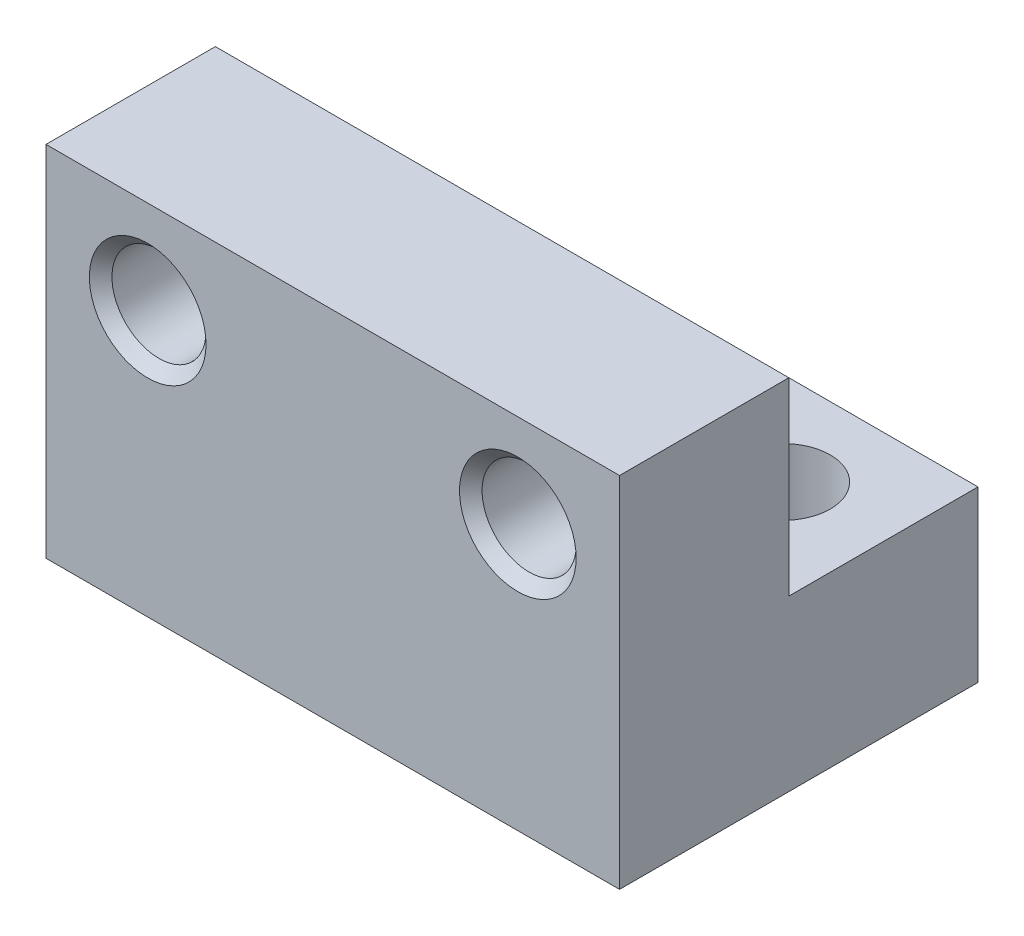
SolidWorks part; units mm, degrees
ref_plane "Front Plane" through (0, 0, 0) normal (0, 0, 1) x (1, 0, 0)
ref_plane "Top Plane" through (0, 0, 0) normal (0, 1, 0) x (1, 0, 0)
ref_plane "Right Plane" through (0, 0, 0) normal (1, 0, 0) x (0, 0, -1)
sketch "Sketch1" plane through (0, 0, 0) normal (1, 0, 0) x (0, 0, -1)
  line L0 (0, 0) -> (0, 9.525)
  line L1 (0, 9.525) -> (4.5, 9.525)
  line L2 (4.5, 9.525) -> (4.5, 4.5)
  line L3 (4.5, 4.5) -> (9.525, 4.5)
  line L4 (9.525, 4.5) -> (9.525, 0)
  line L5 (9.525, 0) -> (0, 0)
  line L6 (0, 0) -> (0.3027, 0)
  dimension "D1" = 9.525
  dimension "D2" = 9.525
  dimension "D3" = 4.5
  dimension "D4" = 4.5
extrude "Boss-Extrude1" add sketch "Sketch1" along normal blind 15.24 contours L5 L4 L3 L2 L1 L0
hole_wizard "M3x0.5 Tapped Hole1" positions "Sketch3" profile "Sketch2" tap size "M3x0.5" standard "Ansi Metric"
sketch "Sketch3" plane through (0, 0, 0) normal (0, 0, 1) x (1, 0, 0)
  line L1 (15.24, 0) -> (0, 0) construction
  line L2 (7.62, 0) -> (7.62, 9.525) construction
  line L3 (15.24, 9.525) -> (0, 9.525) construction
  point P0 (2.7025, 7.05)
  point P1 (12.5375, 7.05)
  dimension "D1" = 7.05
  dimension "D2" = 9.835
  dimension "D3" = 4.9175
sketch "Sketch2" plane through (2.7025, 7.05, 0) normal (1, 0, 0) x (0, -1, 0)
  line L0 (0, 0) -> (0, 9.525)
  line L1 (0, 9.525) -> (1.25, 9.525)
  line L2 (1.25, 9.525) -> (1.25, 0)
  line L5 (1.25, 0) -> (0, 0)
  line L11 (0, -6.35) -> (0, 107.95) construction
  dimension "Thru Tap Drill Dia." = 2.5
  dimension "Thru Tap Drill Depth" = 9.525
hole_wizard "M3x0.5 Tapped Hole2" positions "Sketch5" profile "Sketch4" tap size "M3x0.5" standard "Ansi Metric"
sketch "Sketch5" plane through (0, 0, 0) normal (0, -1, 0) x (1, 0, 0)
  line L0 (15.24, 0) -> (0, 0) construction
  line L1 (7.62, 0) -> (7.62, -9.525) construction
  line L2 (15.24, -9.525) -> (0, -9.525) construction
  point P0 (12.5375, -7.05)
  point P1 (2.7025, -7.05)
  dimension "D1" = 7.05
  dimension "D2" = 9.835
  dimension "D3" = 4.9175
sketch "Sketch4" plane through (12.5375, 0, -7.05) normal (1, 0, 0) x (0, 0, -1)
  line L0 (0, 0) -> (0, 9.525)
  line L1 (0, 9.525) -> (1.25, 9.525)
  line L2 (1.25, 9.525) -> (1.25, 0)
  line L5 (1.25, 0) -> (0, 0)
  line L11 (0, -6.35) -> (0, 107.95) construction
  dimension "Thru Tap Drill Dia." = 2.5
  dimension "Thru Tap Drill Depth" = 9.525
chamfer "Chamfer1" distance 0.3 angle 45 4 edges at (13.7875, 7.05, 0) (3.9525, 7.05, 0) (2.7025, 0, -8.3) (12.5375, 0, -8.3)
equation "\"D3@Sketch3\" = \"D2@Sketch3\"/2"
equation "\"D3@Sketch5\" = \"D2@Sketch5\"/2"
